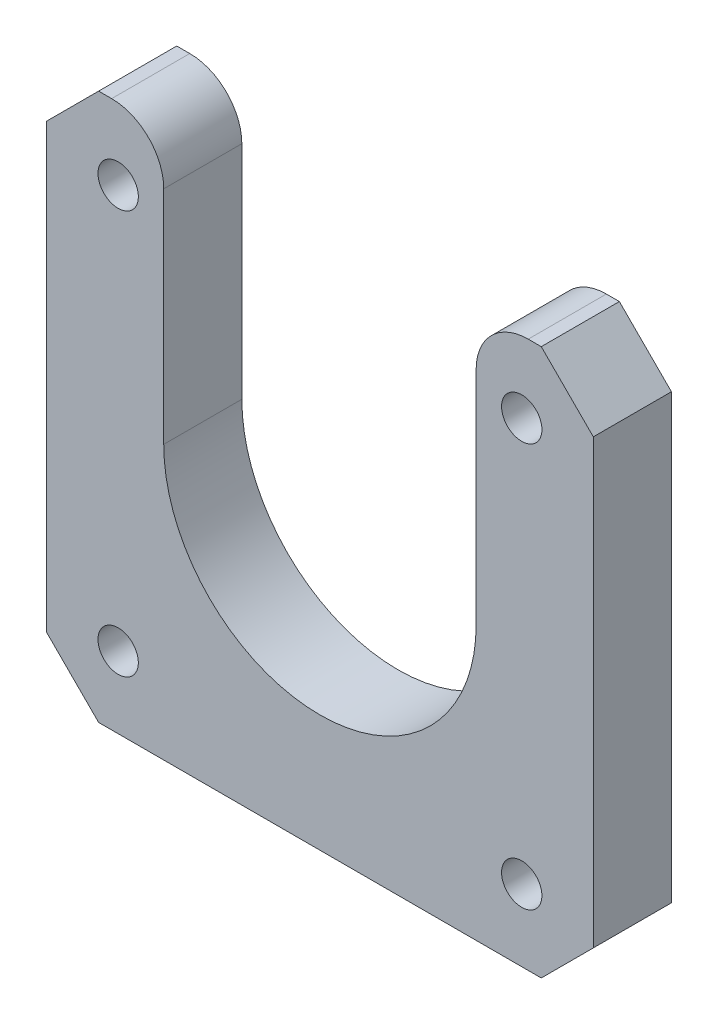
SolidWorks part; units mm, degrees
ref_plane "Спереди" through (0, 0, 0) normal (0, 0, 1) x (1, 0, 0)
ref_plane "Сверху" through (0, 0, 0) normal (0, 1, 0) x (1, 0, 0)
ref_plane "Справа" through (0, 0, 0) normal (1, 0, 0) x (0, 0, -1)
sketch "Эскиз1" plane through (0, 0, 0) normal (0, 0, 1) x (1, 0, 0)
  line L0 (0, 32.7209) -> (0, 0) construction
  line L1 (-21, -21) -> (21, -21)
  line L2 (-21, -21) -> (-21, 21)
  line L3 (-21, 21) -> (-12, 21)
  line L4 (21, -21) -> (21, 21)
  line L5 (-21, -21) -> (21, 21) construction
  line L6 (-21, 21) -> (21, -21) construction
  line L7 (0, 0) -> (27.2361, 0) construction
  line L8 (12, 0) -> (12, 21)
  line L9 (-12, 0) -> (-12, 21)
  line L10 (12, 21) -> (21, 21)
  arc A0 (-12, 0) -> (12, 0) centre (0, 0) ccw
  circle A1 centre (15.5, 15.5) radius 1.55
  circle A2 centre (-15.5, 15.5) radius 1.55
  circle A3 centre (-15.5, -15.5) radius 1.55
  circle A4 centre (15.5, -15.5) radius 1.55
  dimension "D1" = 24
  dimension "D3" = 31
  dimension "D4" = 3.1
  dimension "D2" = 42
extrude "Бобышка-Вытянуть1" add sketch "Эскиз1" along normal blind 6
chamfer "Фаска1" distance 4 angle 45 4 edges at (-21, -21, 3) (-21, 21, 3) (21, -21, 3) (21, 21, 3)
fillet "Скругление1" radius 4 2 edges at (12, 21, 3) (-12, 21, 3)
